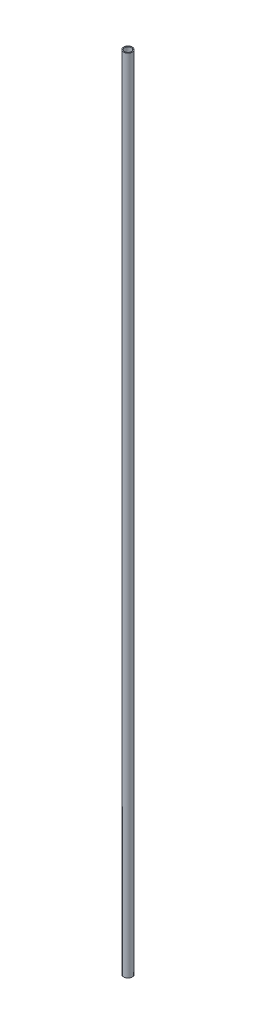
SolidWorks part; units mm, degrees
ref_plane "Front Plane" through (0, 0, 0) normal (0, 0, 1) x (1, 0, 0)
ref_plane "Top Plane" through (0, 0, 0) normal (0, 1, 0) x (1, 0, 0)
ref_plane "Right Plane" through (0, 0, 0) normal (1, 0, 0) x (0, 0, -1)
sketch "Sketch1" plane through (0, 0, 0) normal (0, 1, 0) x (1, 0, 0)
  circle A0 centre (0, 0) radius 13.0683
  circle A1 centre (0, 0) radius 16.7005
  dimension "D1" = 33.401
  dimension "D2" = 26.1366
extrude "Boss-Extrude1" add sketch "Sketch1" along normal blind 3048
